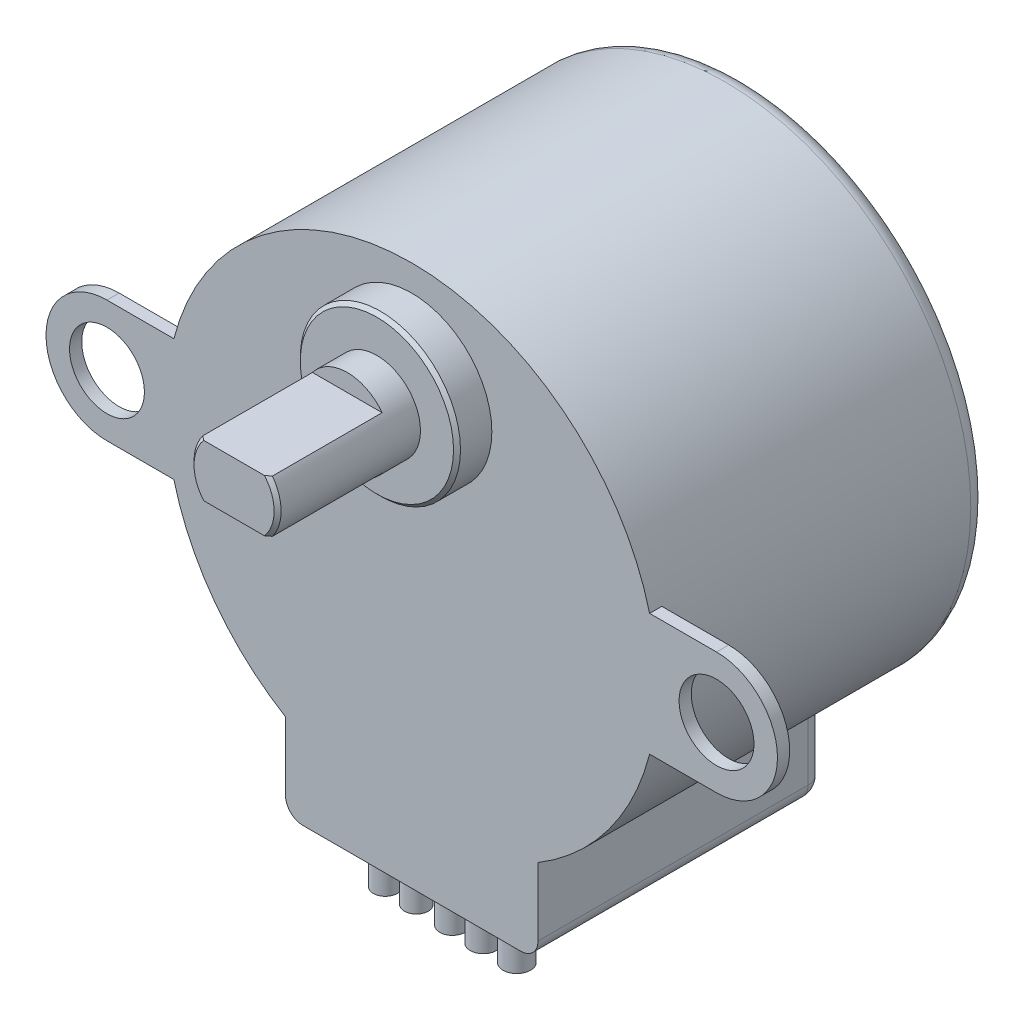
SolidWorks part; units mm, degrees
ref_plane "前视" through (0, 0, 0) normal (0, 0, 1) x (1, 0, 0)
ref_plane "上视" through (0, 0, 0) normal (0, 1, 0) x (1, 0, 0)
ref_plane "右视" through (0, 0, 0) normal (1, 0, 0) x (0, 0, -1)
sketch "草图1" plane through (0, 0, 0) normal (0, 0, 1) x (1, 0, 0)
  line L0 (0, 0) -> (0, -27.8833) construction
  circle A0 centre (0, 0) radius 14.1
  dimension "D1" = 28.2
extrude "凸台-拉伸1" add sketch "草图1" along normal blind 19
sketch "草图2" plane through (0, 0, 19) normal (0, 0, 1) x (1, 0, 0)
  line L0 (0, 0) -> (0, 14.7645) construction
  line L1 (-21.5247, 0) -> (21.5247, 0) construction
  line L2 (-17.5, 0) -> (17.5, 0) construction
  line L3 (-17.5, 3.5) -> (17.5, 3.5)
  line L4 (-17.5, -3.5) -> (17.5, -3.5)
  arc A0 (-17.5, 3.5) -> (-17.5, -3.5) centre (-17.5, 0) ccw
  arc A1 (17.5, -3.5) -> (17.5, 3.5) centre (17.5, 0) ccw
  circle A2 centre (-17.5, 0) radius 2.15
  circle A3 centre (17.5, 0) radius 2.15
  point P7 (0, 0)
  dimension "D2" = 35
  dimension "D3" = 4.3
  dimension "D1" = 7
extrude "凸台-拉伸2" add sketch "草图2" against normal blind 0.7
fillet "圆角1" radius 1 1 edges at (14.1, 0, 0)
sketch "草图3" plane through (0, 0, 19) normal (0, 0, 1) x (1, 0, 0)
  line L0 (0, 0) -> (0, 15.6713) construction
  circle A0 centre (0, 8) radius 4.6
  dimension "D1" = 8
  dimension "D2" = 9.2
extrude "凸台-拉伸3" add sketch "草图3" along normal blind 2
sketch "草图4" plane through (0, 0, 21) normal (0, 0, 1) x (1, 0, 0)
  circle A0 centre (0, 8) radius 2.5
  dimension "D1" = 5
extrude "凸台-拉伸4" add sketch "草图4" along normal blind 8.2
sketch "草图5" plane through (0, 0, 29.2) normal (0, 0, 1) x (1, 0, 0)
  line L0 (-6.2974, 8) -> (5.9609, 8) construction
  line L1 (-2, 9.5) -> (2, 9.5)
  line L2 (-2, 6.5) -> (2, 6.5)
  circle A0 centre (0, 8) radius 2.5 construction
  arc A1 (-2, 6.5) -> (2, 6.5) centre (0, 8) ccw
  circle A2 centre (0, 8) radius 2.5 construction
  arc A3 (2, 9.5) -> (-2, 9.5) centre (0, 8) ccw
  dimension "D1" = 3
extrude "切除-拉伸1" cut sketch "草图5" against normal blind 6.5
chamfer "倒角1" distance 0.2 angle 45 3 edges at (-2.5, 8, 29.2) (2.5, 8, 29.2) (4.6, 8, 21)
sketch "草图6" plane through (0, 0, 19) normal (0, 0, 1) x (1, 0, 0)
  line L0 (0, 0) -> (0, -24.7541) construction
  line L3 (-7.25, -12.0933) -> (-7.25, -17)
  line L4 (-7.25, -17) -> (7.25, -17)
  line L5 (7.25, -12.0933) -> (7.25, -17)
  arc A0 (-13.6587, -3.5) -> (13.6587, -3.5) centre (0, 0) ccw construction
  arc A1 (-7.25, -12.0933) -> (7.25, -12.0933) centre (0, 0) ccw
  dimension "D1" = 14.5
  dimension "D2" = 17
extrude "凸台-拉伸5" add sketch "草图6" against normal blind 16.5
fillet "圆角2" radius 1 5 edges at (7.25, -17, 10.75) (7.25, -14.5466, 2.5) (0, -17, 2.5) (-7.25, -17, 10.75) (-7.25, -14.5466, 2.5)
sketch "草图7" plane through (0, -17, 0) normal (0, -1, 0) x (1, 0, 0)
  circle A0 centre (-3.8457, 16.6671) radius 0.6933
  circle A1 centre (-2.0671, 16.6671) radius 0.6832
  circle A2 centre (0, 16.6671) radius 0.7211
  circle A3 centre (1.7786, 16.6671) radius 0.7524
  circle A4 centre (3.7015, 16.6671) radius 0.7884
extrude "凸台-拉伸6" add sketch "草图7" along normal blind 3
